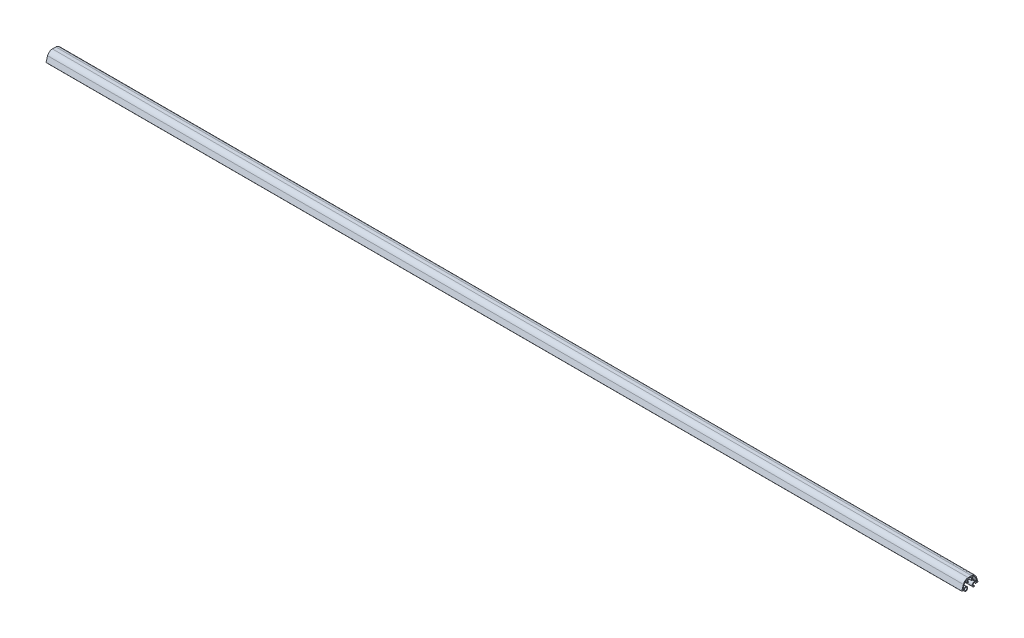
SolidWorks part; units mm, degrees
ref_plane "Plan de face" through (0, 0, 0) normal (0, 0, 1) x (1, 0, 0)
ref_plane "Plan de dessus" through (0, 0, 0) normal (0, 1, 0) x (1, 0, 0)
ref_plane "Plan de droite" through (0, 0, 0) normal (1, 0, 0) x (0, 0, -1)
sketch "Esquisse1" plane through (0, 0, 0) normal (1, 0, 0) x (0, 0, -1)
  line L0 (0, -3.3) -> (0, 15.5559) construction
  line L1 (-2, 0) -> (2, 0) construction
  line L2 (7.708, 1.8491) -> (9.6152, -4.0384)
  line L3 (9.7, -4.3) -> (9.7, 10.347) construction
  line L4 (2, 6) -> (-2, 6)
  line L5 (5.6237, -6.0821) -> (5.6813, -6.2779)
  line L6 (2.245, 1) -> (2, 1)
  line L7 (8.6019, -3.5194) -> (8.6019, 2.2892) construction
  line L8 (9.425, -4.3) -> (7.6, -4.3)
  line L9 (6.6985, 1.7101) -> (8.2368, -2.7701)
  line L10 (7.8584, -3.3) -> (7.6397, -3.3)
  line L11 (7.6, -4.3) -> (6.7882, -4.3)
  line L12 (-8.6019, -3.5194) -> (-8.6019, 2.2892) construction
  line L13 (-9.7, -4.3) -> (-9.7, 10.347) construction
  line L14 (-7.6, -4.3) -> (-6.7882, -4.3)
  line L15 (-7.8584, -3.3) -> (-7.6397, -3.3)
  line L16 (-6.6985, 1.7101) -> (-8.2368, -2.7701)
  line L17 (-9.425, -4.3) -> (-7.6, -4.3)
  line L18 (-2.245, 1) -> (-2, 1)
  line L19 (-5.6237, -6.0821) -> (-5.6813, -6.2779)
  line L20 (-7.708, 1.8491) -> (-9.6152, -4.0384)
  arc A0 (7.708, 1.8491) -> (2, 6) centre (2, 0) ccw
  arc A1 (6.6985, 1.7101) -> (2.7681, 4.9406) centre (2, 0) ccw
  arc A2 (7.2894, -3.0931) -> (5.3351, -6.7889) centre (5.1, -4.3) ccw
  arc A3 (1.68, 1.64) -> (-1.68, 1.64) centre (0, 2.9) ccw
  arc A4 (2.5776, 1.1778) -> (2.5715, 4.6313) centre (0, 2.9) ccw
  arc A5 (6.5896, -4.1235) -> (5.2105, -5.7959) centre (5.1, -4.3) ccw
  arc A6 (7.6397, -3.3) -> (7.2894, -3.0931) centre (7.6397, -2.9) cw
  arc A7 (7.8584, -3.3) -> (8.2368, -2.7701) centre (7.8584, -2.9) ccw
  arc A8 (5.6237, -6.0821) -> (5.2105, -5.7959) centre (5.2399, -6.1948) ccw
  arc A9 (5.6813, -6.2779) -> (5.3351, -6.7889) centre (5.2975, -6.3907) cw
  arc A10 (1.68, 1.64) -> (2, 1) centre (2, 1.4) ccw
  arc A11 (2.5776, 1.1778) -> (2.245, 1) centre (2.245, 1.4) cw
  arc A12 (2.7681, 4.9406) -> (2.5715, 4.6313) centre (2.7374, 4.743) ccw
  arc A13 (6.7882, -4.3) -> (6.5896, -4.1235) centre (6.7882, -4.1) cw
  arc A14 (9.6152, -4.0384) -> (9.425, -4.3) centre (9.425, -4.1) cw
  arc A15 (-9.6152, -4.0384) -> (-9.425, -4.3) centre (-9.425, -4.1) ccw
  arc A16 (-6.7882, -4.3) -> (-6.5896, -4.1235) centre (-6.7882, -4.1) ccw
  arc A17 (-2.7681, 4.9406) -> (-2.5715, 4.6313) centre (-2.7374, 4.743) cw
  arc A18 (-2.5776, 1.1778) -> (-2.245, 1) centre (-2.245, 1.4) ccw
  arc A19 (-1.68, 1.64) -> (-2, 1) centre (-2, 1.4) cw
  arc A20 (-5.6813, -6.2779) -> (-5.3351, -6.7889) centre (-5.2975, -6.3907) ccw
  arc A21 (-5.6237, -6.0821) -> (-5.2105, -5.7959) centre (-5.2399, -6.1948) cw
  arc A22 (-7.8584, -3.3) -> (-8.2368, -2.7701) centre (-7.8584, -2.9) cw
  arc A23 (-7.6397, -3.3) -> (-7.2894, -3.0931) centre (-7.6397, -2.9) ccw
  arc A24 (-6.5896, -4.1235) -> (-5.2105, -5.7959) centre (-5.1, -4.3) cw
  arc A25 (-2.5776, 1.1778) -> (-2.5715, 4.6313) centre (0, 2.9) cw
  arc A26 (-7.2894, -3.0931) -> (-5.3351, -6.7889) centre (-5.1, -4.3) cw
  arc A27 (-6.6985, 1.7101) -> (-2.7681, 4.9406) centre (-2, 0) cw
  arc A28 (-7.708, 1.8491) -> (-2, 6) centre (-2, 0) cw
  point P5 (-6.6, -4.3)
  point P41 (6.6, -4.3)
  point P50 (0, 0)
  point P81 (0, 6)
  dimension "D2" = 12
  dimension "D5" = 10
  dimension "D6" = 5
  dimension "D7" = 5
  dimension "D9" = 3
  dimension "D10" = 0.4
  dimension "D13" = 0.2
  dimension "D1" = 2
  dimension "D3" = 10.3
  dimension "D4" = 9.7
  dimension "D8" = 4.6
  dimension "D11" = 1
  dimension "D12" = 1
extrude "Boss.-Extru.1" add sketch "Esquisse1" along normal blind 1087
